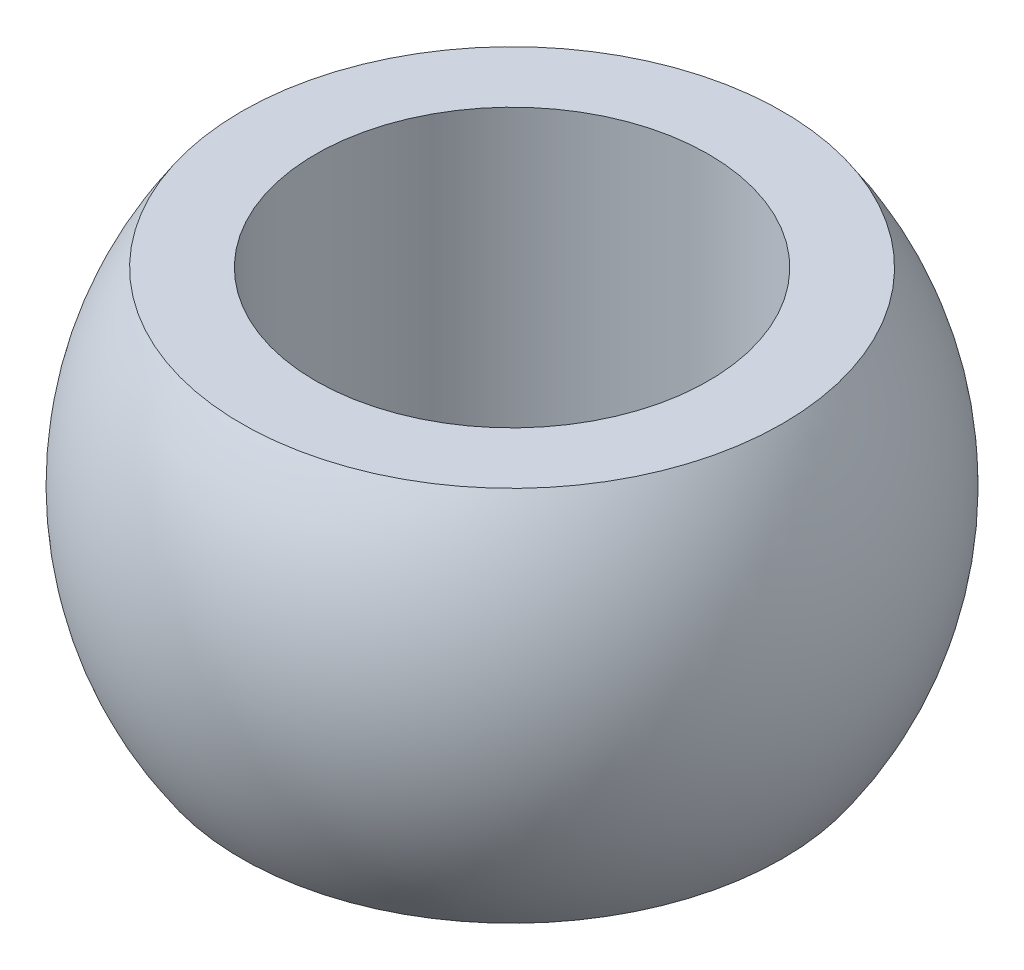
SolidWorks part; units mm, degrees
ref_plane "Plane1" through (0, 0, 0) normal (0, 0, 1) x (1, 0, 0)
ref_plane "Plane2" through (0, 0, 0) normal (0, 1, 0) x (1, 0, 0)
ref_plane "Plane3" through (0, 0, 0) normal (1, 0, 0) x (0, 0, -1)
sketch "Esquisse1" plane through (0, 0, 0) normal (0, 0, 1) x (1, 0, 0)
  line L0 (0, 20.7018) -> (0, -22.6936) construction
  line L1 (-20.106, 14) -> (-14.6, 14)
  line L2 (-20.106, -14) -> (-14.6, -14)
  line L3 (-14.6, 14) -> (-14.6, -14)
  arc A0 (-20.106, 14) -> (-20.106, -14) centre (0, 0) ccw
revolve "Base-Révolution" add sketch "Esquisse1" angle 360 about L0
equation "\"D4@Esquisse1\" = \"D1@Esquisse1\" / 2"
